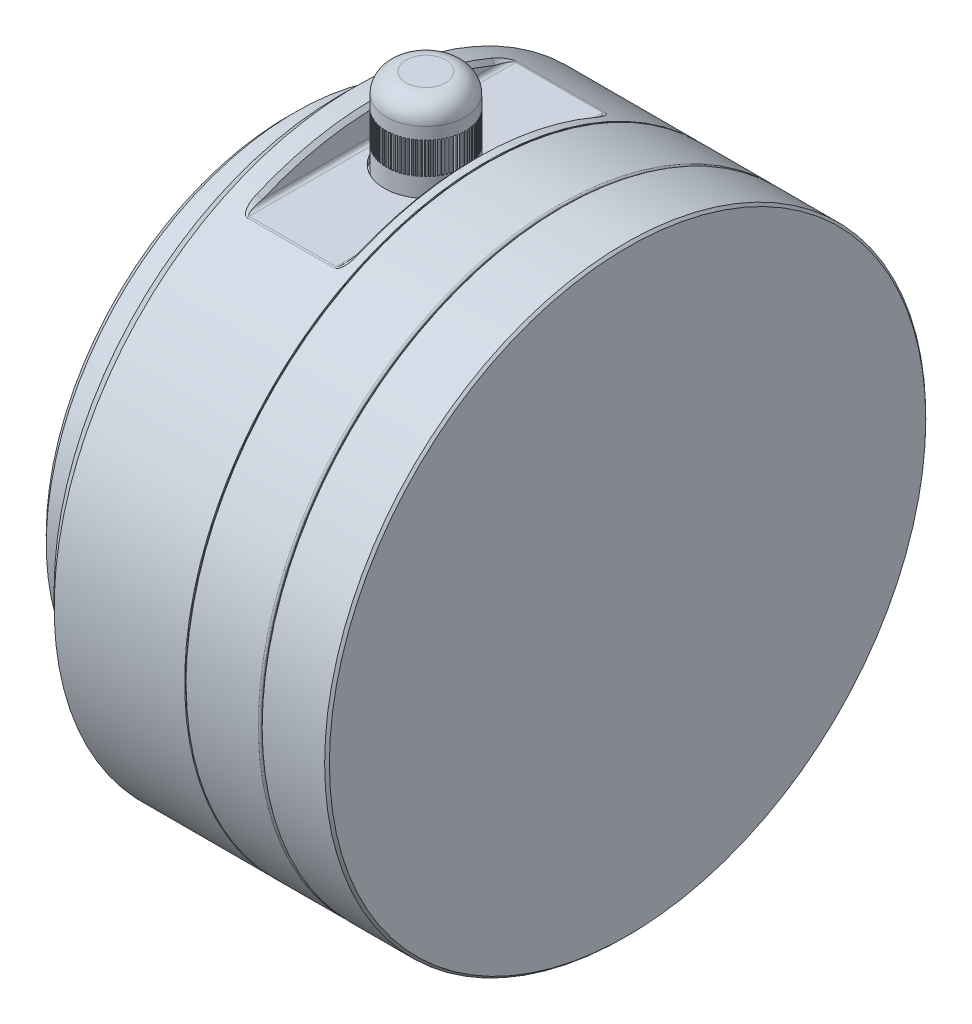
SolidWorks part; units mm, degrees
ref_plane "前视基准面" through (0, 0, 0) normal (0, 0, 1) x (1, 0, 0)
ref_plane "上视基准面" through (0, 0, 0) normal (0, 1, 0) x (1, 0, 0)
ref_plane "右视基准面" through (0, 0, 0) normal (1, 0, 0) x (0, 0, -1)
imported_body "flange1"
imported_body "flange2"
imported_body "flange3"
imported_body "flange4"
sketch "草图1" plane through (37, 0, 0) normal (1, 0, 0) x (0, 0, -1)
  circle A0 centre (0, 0) radius 37.5
  dimension "D1" = 75
extrude "凸台-拉伸1" add sketch "草图1" against normal up to surface (13.5 mm away)
sketch "草图2" plane through (23.5, 0, 0) normal (-1, 0, 0) x (0, 0, 1)
  line L0 (-17.8115, 33) -> (17.8115, 33)
  arc A0 (-17.8115, 33) -> (17.8115, 33) centre (0, 0) ccw
  dimension "D1" = 75
  dimension "D2" = 33
extrude "凸台-拉伸2" add sketch "草图2" along normal up to surface (9.3 mm away)
sketch "草图5" plane through (14.2, 0, 0) normal (-1, 0, 0) x (0, 0, 1)
  line L7 (4.8217, 27.8) -> (3.2047, 27.8)
  line L8 (2.4331, 28.3) -> (2.4331, 32.7)
  line L9 (2.9103, 33) -> (-2.9103, 33)
  line L10 (-2.4331, 32.7) -> (-2.4331, 28.3)
  line L11 (-3.2047, 27.8) -> (-4.8217, 27.8)
  line L12 (-12.7607, -16.7705) -> (-11.2265, -25.0857)
  line L13 (11.2265, -25.0857) -> (12.7607, -16.7705)
  line L14 (4.8217, 27.8) -> (3.2047, 27.8)
  line L15 (2.4331, 28.3) -> (2.4331, 32.7)
  line L16 (2.9103, 33) -> (-2.9103, 33)
  line L17 (-2.4331, 32.7) -> (-2.4331, 28.3)
  line L18 (-3.2047, 27.8) -> (-4.8217, 27.8)
  line L19 (-12.7607, -16.7705) -> (-11.2265, -25.0857)
  line L20 (11.2265, -25.0857) -> (12.7607, -16.7705)
  arc A23 (12.7543, 18.5499) -> (9.331, 22.5013) centre (9.44, 19.1371) ccw
  arc A24 (6.7898, 25.4444) -> (9.331, 22.5013) centre (9.25, 25) ccw
  arc A25 (6.7898, 25.4444) -> (4.8217, 27.8) centre (4.8217, 25.8) ccw
  arc A26 (-4.8217, 27.8) -> (-6.7898, 25.4444) centre (-4.8217, 25.8) ccw
  arc A27 (-9.331, 22.5013) -> (-6.7898, 25.4444) centre (-9.25, 25) ccw
  arc A28 (-9.331, 22.5013) -> (-12.7543, 18.5499) centre (-9.44, 19.1371) ccw
  arc A29 (-19.3598, 12.9691) -> (-12.7543, 18.5499) centre (-17.6777, 17.6777) ccw
  arc A30 (-19.3598, 12.9691) -> (-32.6041, 5.0964) centre (-22.7241, 3.552) ccw
  arc A31 (-32.6041, 5.0964) -> (-32.6041, -5.0964) centre (0, 0) ccw
  arc A32 (-32.6041, -5.0964) -> (-19.3598, -12.9691) centre (-22.7241, -3.552) ccw
  arc A33 (-12.7607, -16.7705) -> (-19.3598, -12.9691) centre (-17.6777, -17.6777) ccw
  arc A34 (-11.2265, -25.0857) -> (-9.9612, -26.5957) centre (-9.2597, -24.7228) ccw
  arc A35 (-9.9612, -26.5957) -> (-5.0335, -27.9504) centre (0, 0) ccw
  arc A36 (-5.0335, -27.9504) -> (-2.7089, -26.3264) centre (-4.679, -25.982) ccw
  arc A37 (2.7089, -26.3264) -> (-2.7089, -26.3264) centre (0, -26.8) ccw
  arc A38 (2.7089, -26.3264) -> (5.0335, -27.9504) centre (4.679, -25.982) ccw
  arc A39 (5.0335, -27.9504) -> (9.9612, -26.5957) centre (0, 0) ccw
  arc A40 (9.9612, -26.5957) -> (11.2265, -25.0857) centre (9.2597, -24.7228) ccw
  arc A41 (19.3598, -12.9691) -> (12.7607, -16.7705) centre (17.6777, -17.6777) ccw
  arc A42 (19.3598, -12.9691) -> (32.6041, -5.0964) centre (22.7241, -3.552) ccw
  arc A43 (32.6041, -5.0964) -> (32.6041, 5.0964) centre (0, 0) ccw
  arc A44 (32.6041, 5.0964) -> (19.3598, 12.9691) centre (22.7241, 3.552) ccw
  arc A45 (12.7543, 18.5499) -> (19.3598, 12.9691) centre (17.6777, 17.6777) ccw
  arc A46 (12.7543, 18.5499) -> (9.331, 22.5013) centre (9.44, 19.1371) ccw
  arc A47 (6.7898, 25.4444) -> (9.331, 22.5013) centre (9.25, 25) ccw
  arc A48 (6.7898, 25.4444) -> (4.8217, 27.8) centre (4.8217, 25.8) ccw
  arc A49 (-4.8217, 27.8) -> (-6.7898, 25.4444) centre (-4.8217, 25.8) ccw
  arc A50 (-9.331, 22.5013) -> (-6.7898, 25.4444) centre (-9.25, 25) ccw
  arc A51 (-9.331, 22.5013) -> (-12.7543, 18.5499) centre (-9.44, 19.1371) ccw
  arc A52 (-19.3598, 12.9691) -> (-12.7543, 18.5499) centre (-17.6777, 17.6777) ccw
  arc A53 (-19.3598, 12.9691) -> (-32.6041, 5.0964) centre (-22.7241, 3.552) ccw
  arc A54 (-32.6041, 5.0964) -> (-32.6041, -5.0964) centre (0, 0) ccw
  arc A55 (-32.6041, -5.0964) -> (-19.3598, -12.9691) centre (-22.7241, -3.552) ccw
  arc A56 (-12.7607, -16.7705) -> (-19.3598, -12.9691) centre (-17.6777, -17.6777) ccw
  arc A57 (-11.2265, -25.0857) -> (-9.9612, -26.5957) centre (-9.2597, -24.7228) ccw
  arc A58 (-9.9612, -26.5957) -> (-5.0335, -27.9504) centre (0, 0) ccw
  arc A59 (-5.0335, -27.9504) -> (-2.7089, -26.3264) centre (-4.679, -25.982) ccw
  arc A60 (2.7089, -26.3264) -> (-2.7089, -26.3264) centre (0, -26.8) ccw
  arc A61 (2.7089, -26.3264) -> (5.0335, -27.9504) centre (4.679, -25.982) ccw
  arc A62 (5.0335, -27.9504) -> (9.9612, -26.5957) centre (0, 0) ccw
  arc A63 (9.9612, -26.5957) -> (11.2265, -25.0857) centre (9.2597, -24.7228) ccw
  arc A64 (19.3598, -12.9691) -> (12.7607, -16.7705) centre (17.6777, -17.6777) ccw
  arc A65 (19.3598, -12.9691) -> (32.6041, -5.0964) centre (22.7241, -3.552) ccw
  arc A66 (32.6041, -5.0964) -> (32.6041, 5.0964) centre (0, 0) ccw
  arc A67 (32.6041, 5.0964) -> (19.3598, 12.9691) centre (22.7241, 3.552) ccw
  arc A68 (12.7543, 18.5499) -> (19.3598, 12.9691) centre (17.6777, 17.6777) ccw
  spline S4 degree 3 poles (1785.7647, 2439.9351) (-1697.4863, -2446.6255) (1706.1711, 2500.5867) (-1777.1592, -2386.0871) knots -83.141839 -83.141839 -83.141839 -83.141839 80.090237 80.090237 80.090237 80.090237 only from (3.2047, 27.8) to (2.4331, 28.3)
  spline S5 degree 3 poles (861.4607, 2906.1141) (-1005.4658, -2858.4041) (1095.5202, 2896.5604) (-1105.4691, -2754.6217) knots -108.717759 -108.717759 -108.717759 -108.717759 112.270349 112.270349 112.270349 112.270349 only from (2.4331, 32.7) to (2.9103, 33)
  spline S6 degree 3 poles (-1792.49, -2374.0011) (1707.1446, 2499.2424) (-1715.4711, -2431.5013) (1784.2653, 2441.8865) knots -130.733673 -130.733673 -130.733673 -130.733673 125.312853 125.312853 125.312853 125.312853 only from (-2.9103, 33) to (-2.4331, 32.7)
  spline S7 degree 3 poles (-66.9292, -2969.976) (211.8461, 3075.7367) (-298.6111, -3017.0361) (296.7254, 3012.7471) knots -74.568982 -74.568982 -74.568982 -74.568982 78.217968 78.217968 78.217968 78.217968 only from (-2.4331, 28.3) to (-3.2047, 27.8)
  spline S8 degree 3 poles (3.2047, 27.8) (2.9534, 27.9751) (2.6972, 28.1432) (2.4331, 28.3) knots 0 0 0 0 1 1 1 1
  spline S9 degree 3 poles (2.4331, 32.7) (2.5945, 32.7958) (2.7538, 32.8965) (2.9103, 33) knots 0 0 0 0 1 1 1 1
  spline S10 degree 3 poles (-2.9103, 33) (-2.7538, 32.8964) (-2.595, 32.7961) (-2.4331, 32.7) knots 0 0 0 0 1 1 1 1
  spline S11 degree 3 poles (-2.4331, 28.3) (-2.6963, 28.1438) (-2.9537, 27.9749) (-3.2047, 27.8) knots 0 0 0 0 1 1 1 1
  dimension "D1" = 0
extrude "凸台-拉伸4" add sketch "草图5" along normal up to body separate body
sketch "草图4" plane through (14.2, 0, 0) normal (-1, 0, 0) x (0, 0, 1)
  circle A0 centre (0, -26.8) radius 1.25 construction
  circle A1 centre (14.5, 22.5) radius 1.25 construction
  circle A2 centre (9.25, 25) radius 1.25 construction
  circle A3 centre (-9.25, 25) radius 1.25 construction
  circle A4 centre (-14.5, 22.5) radius 1.25 construction
  circle A5 centre (0, -26.8) radius 1.25
  circle A6 centre (14.5, 22.5) radius 1.25
  circle A7 centre (9.25, 25) radius 1.25
  circle A8 centre (-9.25, 25) radius 1.25
  circle A9 centre (-14.5, 22.5) radius 1.25
extrude "凸台-拉伸3" add sketch "草图4" along normal up to body separate body
sketch "草图6" plane through (43, 0, 0) normal (1, 0, 0) x (0, 0, -1)
  circle A0 centre (0, 0) radius 35.8 construction
  circle A1 centre (0, 0) radius 35.8
extrude "凸台-拉伸5" add sketch "草图6" against normal blind 10
